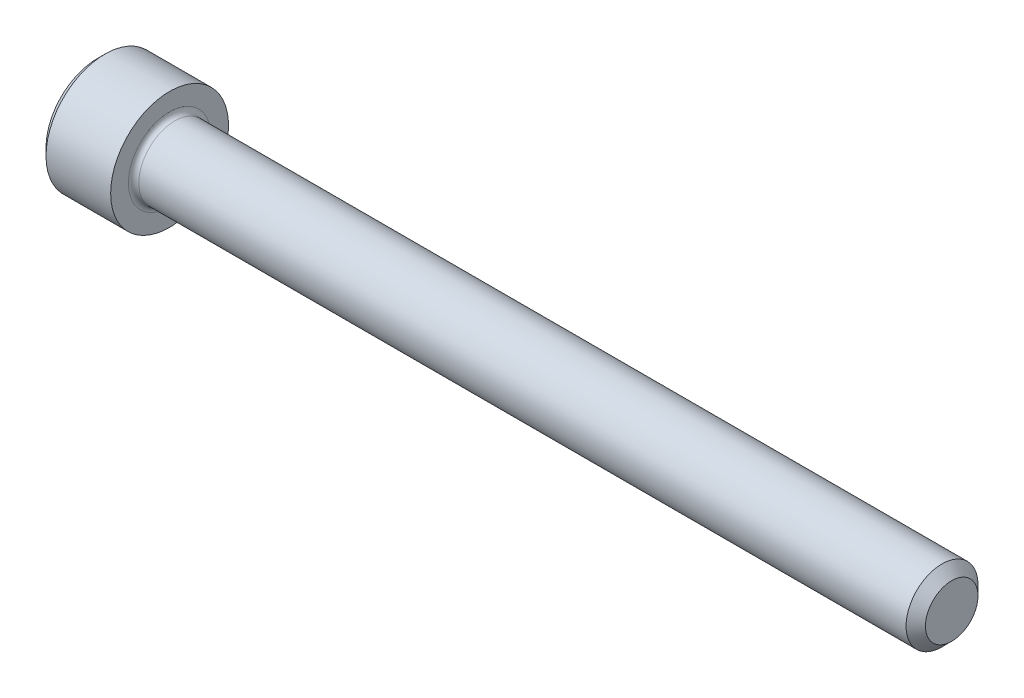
SolidWorks part; units mm, degrees
ref_plane "Plane1" through (0, 0, 0) normal (0, 0, 1) x (1, 0, 0)
ref_plane "Plane2" through (0, 0, 0) normal (0, 1, 0) x (1, 0, 0)
ref_plane "Plane3" through (0, 0, 0) normal (1, 0, 0) x (0, 0, -1)
revolve "Base-Revolve" add sketch "BodySke"
sketch "BodySke" plane through (0, 0, 0) normal (0, 0, 1) x (1, 0, 0)
  line L0 (0, 0) -> (0, 2.5146)
  line L1 (0.3556, 2.8702) -> (3.5052, 2.8702)
  line L2 (3.5052, 2.8702) -> (3.5052, 1.7526)
  line L3 (3.5052, 1.7526) -> (41.1328, 1.7526)
  line L4 (41.6052, 1.2802) -> (41.6052, 0)
  line L5 (41.6052, 0) -> (0, 0)
  line L6 (-31.75, 0) -> (127, 0) construction
  line L7 (0, 2.5146) -> (0.3556, 2.8702)
  line L8 (41.6052, 1.2802) -> (41.1328, 1.7526)
  line L9 (0, -2.5146) -> (0.3556, -2.8702) construction
  line L10 (41.6052, -1.2802) -> (41.1328, -1.7526) construction
  line L11 (4.2977, 9.525) -> (4.2977, 3.175) construction
  line L12 (16.2052, 9.525) -> (16.2052, 3.175) construction
  line L13 (3.5052, 9.525) -> (3.5052, 3.175) construction
  dimension "Diameter" = 3.5052
  dimension "Head_ht" = 3.5052
  dimension "Length" = 38.1
  dimension "Body_ch_ang" = 45
  dimension "Head_dia" = 5.7404
  dimension "Head_ch_ang" = 45
  dimension "Head_side_ht" = 3.1496
  dimension "Minor_dia" = 2.5603
  dimension "Advance" = 0.7925
  dimension "Thread_nom" = 25.4
  dimension "Thread_length" = 38.1
fillet "Fillet1" radius 0.254 1 edges at (3.5052, 0, 1.7526)
sketch "Sketch2" plane through (0, 0, 0) normal (0, 0, 1) x (1, 0, 0)
  line L0 (0, 1.3843) -> (1.6256, 1.3843)
  line L1 (1.6256, 1.3843) -> (2.4248, 0)
  line L2 (-31.75, 0) -> (127, 0) construction
  line L3 (2.4248, 0) -> (0, 0)
  line L4 (0, 0) -> (0, 1.3843)
  line L5 (0, 2.5146) -> (0, -2.5146) construction
  line L6 (0, 0) -> (47.625, 0) construction
  line L7 (3.5052, -2.8702) -> (3.5052, 2.8702) construction
  dimension "D1" = 1.3843
  dimension "D2" = 60
  dimension "Wall_thickness" = 1.8796
revolve "Hex-PreBroach" cut sketch "Sketch2" angle 360 about L6
sketch "Sketch3" plane through (0, 0, 0) normal (-1, 0, 0) x (0, 0.5, 0.866)
  line L0 (0.7992, 1.3843) -> (-0.7992, 1.3843)
  line L1 (-0.7992, 1.3843) -> (-1.5985, 0)
  line L2 (0.7992, 1.3843) -> (1.5985, 0)
  line L3 (0.7992, -1.3843) -> (1.5985, 0)
  line L4 (0.7992, -1.3843) -> (-0.7992, -1.3843)
  line L5 (-0.7992, -1.3843) -> (-1.5985, 0)
  dimension "D1" = 1.3843
  dimension "D2" = 1.3843
  dimension "Hex_size" = 2.7686
extrude "Hex" cut sketch "Sketch3" against normal blind 1.6256
sketch "Sketch4" plane through (0, 0, 0) normal (-1, 0, 0) x (0, 0, 1)
  line L0 (0, 0) -> (1.7399, 0)
  line L1 (0, 0) -> (6.1484, 3.5498) construction
  line L2 (0, 0) -> (0.8699, 1.5068)
  line L3 (1.4457, 0.3947) -> (1.6607, 0.5189)
  line L4 (1.0647, 1.0546) -> (1.2797, 1.1788)
  arc A0 (1.4457, 0.3947) -> (1.0647, 1.0546) centre (0, 0) ccw
  arc A1 (1.7399, 0) -> (1.6607, 0.5189) centre (0, 0) ccw
  arc A2 (0.8699, 1.5068) -> (1.2797, 1.1788) centre (0, 0) cw
  dimension "D1" = 30
  dimension "Spline_n_dim" = 2.9972
  dimension "Spline_m_dim" = 3.4798
  dimension "D2" = 60
  dimension "D3" = 0.381
  dimension "Spline_p_dim" = 0.762
extrude "Spline" [suppressed] cut sketch "Sketch4" against normal blind 1.6256
pattern_circular "CirPattern1" [suppressed] count 6 every 60
sketch "Sketch5" plane through (0, 0, 0) normal (0, 0, 1) x (1, 0, 0)
  line L0 (-31.75, 0) -> (127, 0) construction
  line L2 (0, 2.5146) -> (0, -2.5146) construction
  circle A0 centre (1.27, 0) radius 0.4445
  dimension "Drilled_hole_dia" = 0.889
  dimension "Drilled_hole_loc" = 1.27
extrude "Hole" [suppressed] cut sketch "Sketch5" against normal through all and the other way through all
pattern_circular "Drilled-4" [suppressed] count 2 every 60
pattern_circular "Drilled-6" [suppressed] count 3 every 60
sketch "ThdSchSke" plane through (0, 0, 0) normal (0, 0, 1) x (1, 0, 0)
  line L0 (16.2052, -1.2802) -> (15.8744, -1.7526)
  line L1 (16.2052, -1.2802) -> (16.536, -1.7526)
  line L2 (16.536, -1.7526) -> (16.536, -2.1908)
  line L3 (-3.175, 0) -> (5.1513, 0) construction
  line L5 (16.536, -2.1908) -> (15.8744, -2.1908)
  line L6 (15.8744, -2.1908) -> (15.8744, -1.7526)
  line L7 (0, 2.5146) -> (0, -2.5146) construction
  dimension "Thread_minor" = 2.5603
  dimension "Diameter" = 3.5052
  dimension "Start" = 16.2052
  dimension "SideAngle" = 55
  dimension "VeeAngle" = 70
  dimension "Overcut" = 4.3815
revolve "ThreadSchematic" [suppressed] cut sketch "ThdSchSke" angle 360 about L3
pattern_linear "ThdSchPat" [suppressed]
equation "\"D2@Sketch3\" = \"Hex_size@Sketch3\" / 2"
equation "\"D1@Sketch3\" = \"Hex_size@Sketch3\" / 2"
equation "\"D1@Sketch2\" = \"Hex_size@Sketch3\" / 2"
equation "\"D3@Sketch4\" = \"Spline_p_dim@Sketch4\" / 2"
equation "\"Thread_minor@ThreadCosmetic\"  =  \"Minor_dia@BodySke\""
equation "\"D2@CirPattern1\" = 360 / \"Num_teeth@CirPattern1\""
equation "\"Wall_thickness@Sketch2\" = \"Head_ht@BodySke\" - \"Key_eng@Hex\""
equation "\"Thread_length@ThreadCosmetic\" = ((sgn( (\"Length@BodySke\" - \"Advance@BodySke\" ) - \"Thread_nom@BodySke\" )-1)*( (\"Length@BodySke\" - \"Advance@BodySke\" ) - \"Thread_nom@BodySke\" ))/-2+ \"Thread_nom@BodySke\""
equation "\"Thread_minor@ThdSchSke\" = \"Minor_dia@BodySke\""
equation "\"Diameter@ThdSchSke\" = \"Diameter@BodySke\""
equation "\"Overcut@ThdSchSke\" = \"Diameter@BodySke\" * 1.25"
equation "\"Start@ThdSchSke\" = \"Head_ht@BodySke\" + \"Length@BodySke\" - \"Thread_length@ThreadCosmetic\"  '---Non-countersunk---"
equation "\"Num_threads@ThdSchPat\" = int( \"Thread_length@ThreadCosmetic\" / \"Advance@BodySke\" + 0.999 )  + 1"
equation "\"Advance@ThdSchPat\" = \"Thread_length@ThreadCosmetic\" /  (\"Num_threads@ThdSchPat\" - 1) 'relax it"
equation "\"Num_threads@ThdSchPat\" = \"Num_threads@ThdSchPat\" - sgn( \"Num_threads@ThdSchPat\" - 1) '---chamfered tips only---"
